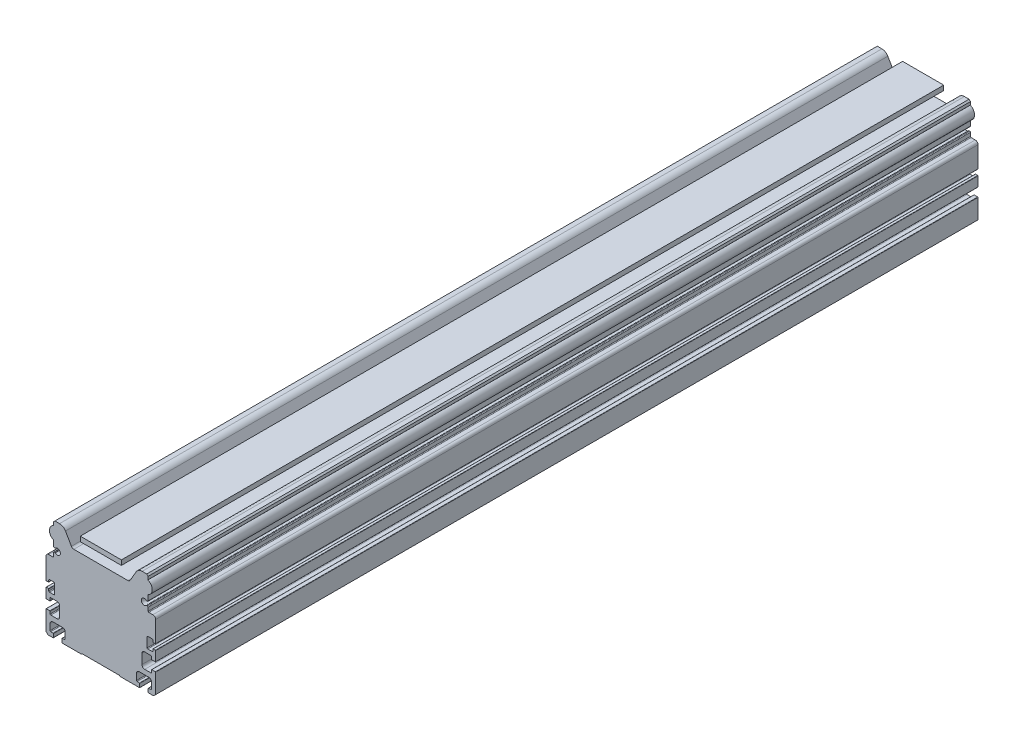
SolidWorks part; units mm, degrees
ref_plane "前视基准面" through (0, 0, 0) normal (0, 0, 1) x (1, 0, 0)
ref_plane "上视基准面" through (0, 0, 0) normal (0, 1, 0) x (1, 0, 0)
ref_plane "右视基准面" through (0, 0, 0) normal (1, 0, 0) x (0, 0, -1)
sketch "草图1" plane through (0, 0, 0) normal (0, 0, 1) x (1, 0, 0)
  line L0 (198.8889, 143.3954) -> (159.4513, 143.3954)
  line L1 (213.6701, 137.8954) -> (213.6701, 141.5168)
  line L2 (213.6701, 131.3954) -> (213.6701, 133.8954)
  line L3 (217.1701, 130.8954) -> (214.1701, 130.8954)
  line L4 (219.1701, 113.5954) -> (219.1701, 128.8954)
  line L5 (213.4701, 115.3954) -> (216.6701, 115.3954)
  line L6 (212.9701, 107.8954) -> (212.9701, 114.8954)
  line L7 (216.6701, 107.3954) -> (213.4701, 107.3954)
  line L8 (219.1701, 102.1954) -> (219.1701, 109.1954)
  line L9 (216.3701, 101.9954) -> (218.9701, 101.9954)
  line L10 (211.1701, 104.3954) -> (215.6701, 104.3954)
  line L11 (209.1701, 95.3954) -> (209.1701, 102.3954)
  line L12 (215.6701, 93.3954) -> (211.1701, 93.3954)
  line L13 (218.9701, 95.7954) -> (216.3701, 95.7954)
  line L14 (219.1701, 81.3954) -> (219.1701, 95.5954)
  line L15 (217.6701, 79.8954) -> (219.1701, 81.3954)
  line L16 (213.9701, 79.8954) -> (217.6701, 79.8954)
  line L17 (213.7701, 82.6954) -> (213.7701, 80.0954)
  line L18 (216.1701, 87.8954) -> (216.1701, 83.3954)
  line L19 (207.1701, 89.8954) -> (214.1701, 89.8954)
  line L20 (205.1701, 83.3954) -> (205.1701, 87.8954)
  line L21 (207.5701, 80.0954) -> (207.5701, 82.6954)
  line L22 (193.1701, 79.8954) -> (207.3701, 79.8954)
  line L23 (165.6701, 80.3954) -> (192.6701, 80.3954)
  line L24 (150.9701, 79.8954) -> (165.1701, 79.8954)
  line L25 (150.7701, 82.6954) -> (150.7701, 80.0954)
  line L26 (153.1701, 87.8954) -> (153.1701, 83.3954)
  line L27 (144.1701, 89.8954) -> (151.1701, 89.8954)
  line L28 (142.1701, 83.3954) -> (142.1701, 87.8954)
  line L29 (144.5701, 80.0954) -> (144.5701, 82.6954)
  line L30 (140.6701, 79.8954) -> (144.3701, 79.8954)
  line L31 (139.1701, 81.3954) -> (140.6701, 79.8954)
  line L32 (139.1701, 95.5954) -> (139.1701, 81.3954)
  line L33 (141.9701, 95.7954) -> (139.3701, 95.7954)
  line L34 (147.1701, 93.3954) -> (142.6701, 93.3954)
  line L35 (149.1701, 102.3954) -> (149.1701, 95.3954)
  line L36 (142.6701, 104.3954) -> (147.1701, 104.3954)
  line L37 (139.3701, 101.9954) -> (141.9701, 101.9954)
  line L38 (139.1701, 109.1954) -> (139.1701, 102.1954)
  line L39 (144.8701, 107.3954) -> (141.6701, 107.3954)
  line L40 (145.3701, 114.8954) -> (145.3701, 107.8954)
  line L41 (141.6701, 115.3954) -> (144.8701, 115.3954)
  line L42 (139.1701, 128.8954) -> (139.1701, 113.5954)
  line L43 (144.1701, 130.8954) -> (141.1701, 130.8954)
  line L44 (144.6701, 133.8954) -> (144.6701, 131.3954)
  line L45 (144.6701, 141.5168) -> (144.6701, 137.8954)
  line L46 (144.6701, 153.3954) -> (144.6701, 151.2739)
  line L47 (149.059, 154.3954) -> (145.6701, 154.3954)
  line L48 (157.7193, 144.3954) -> (153.3892, 151.8954)
  line L49 (204.951, 151.8954) -> (200.6209, 144.3954)
  line L50 (212.6701, 154.3954) -> (209.2812, 154.3954)
  line L51 (213.6701, 151.2739) -> (213.6701, 153.3954)
  line L52 (192.6701, 80.3954) -> (193.1701, 79.8954)
  line L53 (165.1701, 79.8954) -> (165.6701, 80.3954)
  line L54 (145.6701, 154.3954) -> (144.6701, 153.3954)
  line L55 (213.6701, 153.3954) -> (212.6701, 154.3954)
  line L56 (212.5642, 137.3954) -> (213.1701, 137.3954)
  line L57 (213.1701, 134.3954) -> (212.5642, 134.3954)
  line L58 (217.3701, 113.3954) -> (218.9701, 113.3954)
  line L59 (217.1701, 114.8954) -> (217.1701, 113.5954)
  line L60 (217.1701, 109.1954) -> (217.1701, 107.8954)
  line L61 (218.9701, 109.3954) -> (217.3701, 109.3954)
  line L62 (216.1701, 103.8954) -> (216.1701, 102.1954)
  line L63 (216.1701, 95.5954) -> (216.1701, 93.8954)
  line L64 (215.6701, 82.8954) -> (213.9701, 82.8954)
  line L65 (207.3701, 82.8954) -> (205.6701, 82.8954)
  line L66 (152.6701, 82.8954) -> (150.9701, 82.8954)
  line L67 (144.3701, 82.8954) -> (142.6701, 82.8954)
  line L68 (142.1701, 93.8954) -> (142.1701, 95.5954)
  line L69 (142.1701, 102.1954) -> (142.1701, 103.8954)
  line L70 (140.9701, 109.3954) -> (139.3701, 109.3954)
  line L71 (141.1701, 107.8954) -> (141.1701, 109.1954)
  line L72 (141.1701, 113.5954) -> (141.1701, 114.8954)
  line L73 (139.3701, 113.3954) -> (140.9701, 113.3954)
  line L74 (145.776, 134.3954) -> (145.1701, 134.3954)
  line L75 (145.1701, 137.3954) -> (145.776, 137.3954)
  line L76 (164.1701, 150.5454) -> (194.1701, 150.5454)
  line L77 (164.1701, 154.0454) -> (164.1701, 150.5454)
  line L78 (164.1701, 154.0454) -> (194.1701, 154.0454)
  line L79 (194.1701, 154.0454) -> (194.1701, 150.5454)
  arc A0 (157.7193, 144.3954) -> (159.4513, 143.3954) centre (159.4513, 145.3954) ccw
  arc A1 (198.8889, 143.3954) -> (200.6209, 144.3954) centre (198.8889, 145.3954) ccw
  arc A2 (149.2956, 142.1401) -> (150.9253, 143.7699) centre (146.6701, 146.3954) ccw
  arc A3 (149.5348, 142.1183) -> (150.9472, 143.5307) centre (150.2056, 142.8598) ccw
  arc A4 (207.4149, 143.7699) -> (209.0446, 142.1401) centre (211.6701, 146.3954) ccw
  arc A5 (207.393, 143.5307) -> (208.8054, 142.1183) centre (208.0992, 142.8245) ccw
  arc A6 (213.4009, 141.7045) -> (213.4009, 151.0862) centre (211.6701, 146.3954) ccw
  arc A7 (212.423, 137.4537) -> (212.423, 134.337) centre (210.8701, 135.8954) ccw
  arc A8 (219.1701, 128.8954) -> (217.1701, 130.8954) centre (217.1701, 128.8954) ccw
  arc A9 (211.1701, 104.3954) -> (209.1701, 102.3954) centre (211.1701, 102.3954) ccw
  arc A10 (209.1701, 95.3954) -> (211.1701, 93.3954) centre (211.1701, 95.3954) ccw
  arc A11 (216.1701, 87.8954) -> (214.1701, 89.8954) centre (214.1701, 87.8954) ccw
  arc A12 (207.1701, 89.8954) -> (205.1701, 87.8954) centre (207.1701, 87.8954) ccw
  arc A13 (153.1701, 87.8954) -> (151.1701, 89.8954) centre (151.1701, 87.8954) ccw
  arc A14 (144.1701, 89.8954) -> (142.1701, 87.8954) centre (144.1701, 87.8954) ccw
  arc A15 (147.1701, 93.3954) -> (149.1701, 95.3954) centre (147.1701, 95.3954) ccw
  arc A16 (149.1701, 102.3954) -> (147.1701, 104.3954) centre (147.1701, 102.3954) ccw
  arc A17 (141.1701, 130.8954) -> (139.1701, 128.8954) centre (141.1701, 128.8954) ccw
  arc A18 (145.9172, 134.337) -> (145.9172, 137.4537) centre (147.4701, 135.8954) ccw
  arc A19 (144.9393, 151.0862) -> (144.9393, 141.7045) centre (146.6701, 146.3954) ccw
  arc A20 (153.3892, 151.8954) -> (149.059, 154.3954) centre (149.059, 149.3954) ccw
  arc A21 (209.2812, 154.3954) -> (204.951, 151.8954) centre (209.2812, 149.3954) ccw
  arc A22 (149.5348, 142.1183) -> (149.2956, 142.1401) centre (149.4006, 141.9699) ccw
  arc A23 (150.9253, 143.7699) -> (150.9472, 143.5307) centre (151.0955, 143.6649) ccw
  arc A24 (207.393, 143.5307) -> (207.4149, 143.7699) centre (207.2447, 143.6649) ccw
  arc A25 (209.0446, 142.1401) -> (208.8054, 142.1183) centre (208.9396, 141.9699) ccw
  arc A26 (213.4009, 151.0862) -> (213.6701, 151.2739) centre (213.4701, 151.2739) ccw
  arc A27 (213.6701, 141.5168) -> (213.4009, 141.7045) centre (213.4701, 141.5168) ccw
  arc A28 (213.1701, 137.3954) -> (213.6701, 137.8954) centre (213.1701, 137.8954) ccw
  arc A29 (212.423, 137.4537) -> (212.5642, 137.3954) centre (212.5642, 137.5954) ccw
  arc A30 (212.5642, 134.3954) -> (212.423, 134.337) centre (212.5642, 134.1954) ccw
  arc A31 (213.6701, 133.8954) -> (213.1701, 134.3954) centre (213.1701, 133.8954) ccw
  arc A32 (213.6701, 131.3954) -> (214.1701, 130.8954) centre (214.1701, 131.3954) ccw
  arc A33 (218.9701, 113.3954) -> (219.1701, 113.5954) centre (218.9701, 113.5954) ccw
  arc A34 (217.1701, 114.8954) -> (216.6701, 115.3954) centre (216.6701, 114.8954) ccw
  arc A35 (213.4701, 115.3954) -> (212.9701, 114.8954) centre (213.4701, 114.8954) ccw
  arc A36 (212.9701, 107.8954) -> (213.4701, 107.3954) centre (213.4701, 107.8954) ccw
  arc A37 (216.6701, 107.3954) -> (217.1701, 107.8954) centre (216.6701, 107.8954) ccw
  arc A38 (219.1701, 109.1954) -> (218.9701, 109.3954) centre (218.9701, 109.1954) ccw
  arc A39 (218.9701, 101.9954) -> (219.1701, 102.1954) centre (218.9701, 102.1954) ccw
  arc A40 (216.1701, 102.1954) -> (216.3701, 101.9954) centre (216.3701, 102.1954) ccw
  arc A41 (216.1701, 103.8954) -> (215.6701, 104.3954) centre (215.6701, 103.8954) ccw
  arc A42 (215.6701, 93.3954) -> (216.1701, 93.8954) centre (215.6701, 93.8954) ccw
  arc A43 (216.3701, 95.7954) -> (216.1701, 95.5954) centre (216.3701, 95.5954) ccw
  arc A44 (219.1701, 95.5954) -> (218.9701, 95.7954) centre (218.9701, 95.5954) ccw
  arc A45 (213.7701, 80.0954) -> (213.9701, 79.8954) centre (213.9701, 80.0954) ccw
  arc A46 (213.9701, 82.8954) -> (213.7701, 82.6954) centre (213.9701, 82.6954) ccw
  arc A47 (215.6701, 82.8954) -> (216.1701, 83.3954) centre (215.6701, 83.3954) ccw
  arc A48 (205.1701, 83.3954) -> (205.6701, 82.8954) centre (205.6701, 83.3954) ccw
  arc A49 (207.5701, 82.6954) -> (207.3701, 82.8954) centre (207.3701, 82.6954) ccw
  arc A50 (207.3701, 79.8954) -> (207.5701, 80.0954) centre (207.3701, 80.0954) ccw
  arc A51 (150.7701, 80.0954) -> (150.9701, 79.8954) centre (150.9701, 80.0954) ccw
  arc A52 (150.9701, 82.8954) -> (150.7701, 82.6954) centre (150.9701, 82.6954) ccw
  arc A53 (152.6701, 82.8954) -> (153.1701, 83.3954) centre (152.6701, 83.3954) ccw
  arc A54 (142.1701, 83.3954) -> (142.6701, 82.8954) centre (142.6701, 83.3954) ccw
  arc A55 (144.5701, 82.6954) -> (144.3701, 82.8954) centre (144.3701, 82.6954) ccw
  arc A56 (144.3701, 79.8954) -> (144.5701, 80.0954) centre (144.3701, 80.0954) ccw
  arc A57 (139.3701, 95.7954) -> (139.1701, 95.5954) centre (139.3701, 95.5954) ccw
  arc A58 (142.1701, 95.5954) -> (141.9701, 95.7954) centre (141.9701, 95.5954) ccw
  arc A59 (142.1701, 93.8954) -> (142.6701, 93.3954) centre (142.6701, 93.8954) ccw
  arc A60 (142.6701, 104.3954) -> (142.1701, 103.8954) centre (142.6701, 103.8954) ccw
  arc A61 (141.9701, 101.9954) -> (142.1701, 102.1954) centre (141.9701, 102.1954) ccw
  arc A62 (139.1701, 102.1954) -> (139.3701, 101.9954) centre (139.3701, 102.1954) ccw
  arc A63 (139.3701, 109.3954) -> (139.1701, 109.1954) centre (139.3701, 109.1954) ccw
  arc A64 (141.1701, 107.8954) -> (141.6701, 107.3954) centre (141.6701, 107.8954) ccw
  arc A65 (144.8701, 107.3954) -> (145.3701, 107.8954) centre (144.8701, 107.8954) ccw
  arc A66 (145.3701, 114.8954) -> (144.8701, 115.3954) centre (144.8701, 114.8954) ccw
  arc A67 (141.6701, 115.3954) -> (141.1701, 114.8954) centre (141.6701, 114.8954) ccw
  arc A68 (139.1701, 113.5954) -> (139.3701, 113.3954) centre (139.3701, 113.5954) ccw
  arc A69 (144.1701, 130.8954) -> (144.6701, 131.3954) centre (144.1701, 131.3954) ccw
  arc A70 (145.1701, 134.3954) -> (144.6701, 133.8954) centre (145.1701, 133.8954) ccw
  arc A71 (145.9172, 134.337) -> (145.776, 134.3954) centre (145.776, 134.1954) ccw
  arc A72 (145.776, 137.3954) -> (145.9172, 137.4537) centre (145.776, 137.5954) ccw
  arc A73 (144.6701, 137.8954) -> (145.1701, 137.3954) centre (145.1701, 137.8954) ccw
  arc A74 (144.9393, 141.7045) -> (144.6701, 141.5168) centre (144.8701, 141.5168) ccw
  arc A75 (144.6701, 151.2739) -> (144.9393, 151.0862) centre (144.8701, 151.2739) ccw
  arc A76 (217.1701, 113.5954) -> (217.3701, 113.3954) centre (217.3701, 113.5954) ccw
  arc A77 (217.3701, 109.3954) -> (217.1701, 109.1954) centre (217.3701, 109.1954) ccw
  arc A78 (141.1701, 109.1954) -> (140.9701, 109.3954) centre (140.9701, 109.1954) ccw
  arc A79 (140.9701, 113.3954) -> (141.1701, 113.5954) centre (140.9701, 113.5954) ccw
extrude "凸台-拉伸1" add sketch "草图1" along normal blind 600
sketch "草图2" plane through (0, 0, 600) normal (0, 0, 1) x (1, 0, 0)
  line L76 (157.7193, 144.3954) -> (153.3892, 151.8954)
  line L77 (149.059, 154.3954) -> (145.6701, 154.3954)
  line L78 (145.6701, 154.3954) -> (144.6701, 153.3954)
  line L79 (144.6701, 153.3954) -> (144.6701, 151.2739)
  line L80 (144.6701, 141.5168) -> (144.6701, 137.8954)
  line L81 (145.1701, 137.3954) -> (145.776, 137.3954)
  line L82 (145.776, 134.3954) -> (145.1701, 134.3954)
  line L83 (144.6701, 133.8954) -> (144.6701, 131.3954)
  line L84 (144.1701, 130.8954) -> (141.1701, 130.8954)
  line L85 (139.1701, 128.8954) -> (139.1701, 113.5954)
  line L86 (139.3701, 113.3954) -> (140.9701, 113.3954)
  line L87 (141.1701, 113.5954) -> (141.1701, 114.8954)
  line L88 (141.6701, 115.3954) -> (144.8701, 115.3954)
  line L89 (145.3701, 114.8954) -> (145.3701, 107.8954)
  line L90 (144.8701, 107.3954) -> (141.6701, 107.3954)
  line L91 (141.1701, 107.8954) -> (141.1701, 109.1954)
  line L92 (140.9701, 109.3954) -> (139.3701, 109.3954)
  line L93 (139.1701, 109.1954) -> (139.1701, 102.1954)
  line L94 (139.3701, 101.9954) -> (141.9701, 101.9954)
  line L95 (142.1701, 102.1954) -> (142.1701, 103.8954)
  line L96 (142.6701, 104.3954) -> (147.1701, 104.3954)
  line L97 (149.1701, 102.3954) -> (149.1701, 95.3954)
  line L98 (147.1701, 93.3954) -> (142.6701, 93.3954)
  line L99 (142.1701, 93.8954) -> (142.1701, 95.5954)
  line L100 (141.9701, 95.7954) -> (139.3701, 95.7954)
  line L101 (139.1701, 95.5954) -> (139.1701, 81.3954)
  line L102 (139.1701, 81.3954) -> (140.6701, 79.8954)
  line L103 (140.6701, 79.8954) -> (144.3701, 79.8954)
  line L104 (144.5701, 80.0954) -> (144.5701, 82.6954)
  line L105 (144.3701, 82.8954) -> (142.6701, 82.8954)
  line L106 (142.1701, 83.3954) -> (142.1701, 87.8954)
  line L107 (144.1701, 89.8954) -> (151.1701, 89.8954)
  line L108 (153.1701, 87.8954) -> (153.1701, 83.3954)
  line L109 (152.6701, 82.8954) -> (150.9701, 82.8954)
  line L110 (150.7701, 82.6954) -> (150.7701, 80.0954)
  line L111 (150.9701, 79.8954) -> (165.1701, 79.8954)
  line L112 (165.1701, 79.8954) -> (165.6701, 80.3954)
  line L113 (165.6701, 80.3954) -> (192.6701, 80.3954)
  line L114 (192.6701, 80.3954) -> (193.1701, 79.8954)
  line L115 (193.1701, 79.8954) -> (207.3701, 79.8954)
  line L116 (207.5701, 80.0954) -> (207.5701, 82.6954)
  line L117 (207.3701, 82.8954) -> (205.6701, 82.8954)
  line L118 (205.1701, 83.3954) -> (205.1701, 87.8954)
  line L119 (207.1701, 89.8954) -> (214.1701, 89.8954)
  line L120 (216.1701, 87.8954) -> (216.1701, 83.3954)
  line L121 (215.6701, 82.8954) -> (213.9701, 82.8954)
  line L122 (213.7701, 82.6954) -> (213.7701, 80.0954)
  line L123 (213.9701, 79.8954) -> (217.6701, 79.8954)
  line L124 (217.6701, 79.8954) -> (219.1701, 81.3954)
  line L125 (219.1701, 81.3954) -> (219.1701, 95.5954)
  line L126 (218.9701, 95.7954) -> (216.3701, 95.7954)
  line L127 (216.1701, 95.5954) -> (216.1701, 93.8954)
  line L128 (215.6701, 93.3954) -> (211.1701, 93.3954)
  line L129 (209.1701, 95.3954) -> (209.1701, 102.3954)
  line L130 (211.1701, 104.3954) -> (215.6701, 104.3954)
  line L131 (216.1701, 103.8954) -> (216.1701, 102.1954)
  line L132 (216.3701, 101.9954) -> (218.9701, 101.9954)
  line L133 (219.1701, 102.1954) -> (219.1701, 109.1954)
  line L134 (218.9701, 109.3954) -> (217.3701, 109.3954)
  line L135 (217.1701, 109.1954) -> (217.1701, 107.8954)
  line L136 (216.6701, 107.3954) -> (213.4701, 107.3954)
  line L137 (212.9701, 107.8954) -> (212.9701, 114.8954)
  line L138 (213.4701, 115.3954) -> (216.6701, 115.3954)
  line L139 (217.1701, 114.8954) -> (217.1701, 113.5954)
  line L140 (217.3701, 113.3954) -> (218.9701, 113.3954)
  line L141 (219.1701, 113.5954) -> (219.1701, 128.8954)
  line L142 (217.1701, 130.8954) -> (214.1701, 130.8954)
  line L143 (213.6701, 131.3954) -> (213.6701, 133.8954)
  line L144 (213.1701, 134.3954) -> (212.5642, 134.3954)
  line L145 (212.5642, 137.3954) -> (213.1701, 137.3954)
  line L146 (213.6701, 137.8954) -> (213.6701, 141.5168)
  line L147 (213.6701, 151.2739) -> (213.6701, 153.3954)
  line L148 (213.6701, 153.3954) -> (212.6701, 154.3954)
  line L149 (212.6701, 154.3954) -> (209.2812, 154.3954)
  line L150 (204.951, 151.8954) -> (200.6209, 144.3954)
  line L151 (198.8889, 143.3954) -> (159.4513, 143.3954)
  line L152 (157.7193, 144.3954) -> (153.3892, 151.8954)
  line L153 (149.059, 154.3954) -> (145.6701, 154.3954)
  line L154 (145.6701, 154.3954) -> (144.6701, 153.3954)
  line L155 (144.6701, 153.3954) -> (144.6701, 151.2739)
  line L156 (144.6701, 141.5168) -> (144.6701, 137.8954)
  line L157 (145.1701, 137.3954) -> (145.776, 137.3954)
  line L158 (145.776, 134.3954) -> (145.1701, 134.3954)
  line L159 (144.6701, 133.8954) -> (144.6701, 131.3954)
  line L160 (144.1701, 130.8954) -> (141.1701, 130.8954)
  line L161 (139.1701, 128.8954) -> (139.1701, 113.5954)
  line L162 (139.3701, 113.3954) -> (140.9701, 113.3954)
  line L163 (141.1701, 113.5954) -> (141.1701, 114.8954)
  line L164 (141.6701, 115.3954) -> (144.8701, 115.3954)
  line L165 (145.3701, 114.8954) -> (145.3701, 107.8954)
  line L166 (144.8701, 107.3954) -> (141.6701, 107.3954)
  line L167 (141.1701, 107.8954) -> (141.1701, 109.1954)
  line L168 (140.9701, 109.3954) -> (139.3701, 109.3954)
  line L169 (139.1701, 109.1954) -> (139.1701, 102.1954)
  line L170 (139.3701, 101.9954) -> (141.9701, 101.9954)
  line L171 (142.1701, 102.1954) -> (142.1701, 103.8954)
  line L172 (142.6701, 104.3954) -> (147.1701, 104.3954)
  line L173 (149.1701, 102.3954) -> (149.1701, 95.3954)
  line L174 (147.1701, 93.3954) -> (142.6701, 93.3954)
  line L175 (142.1701, 93.8954) -> (142.1701, 95.5954)
  line L176 (141.9701, 95.7954) -> (139.3701, 95.7954)
  line L177 (139.1701, 95.5954) -> (139.1701, 81.3954)
  line L178 (139.1701, 81.3954) -> (140.6701, 79.8954)
  line L179 (140.6701, 79.8954) -> (144.3701, 79.8954)
  line L180 (144.5701, 80.0954) -> (144.5701, 82.6954)
  line L181 (144.3701, 82.8954) -> (142.6701, 82.8954)
  line L182 (142.1701, 83.3954) -> (142.1701, 87.8954)
  line L183 (144.1701, 89.8954) -> (151.1701, 89.8954)
  line L184 (153.1701, 87.8954) -> (153.1701, 83.3954)
  line L185 (152.6701, 82.8954) -> (150.9701, 82.8954)
  line L186 (150.7701, 82.6954) -> (150.7701, 80.0954)
  line L187 (150.9701, 79.8954) -> (165.1701, 79.8954)
  line L188 (165.1701, 79.8954) -> (165.6701, 80.3954)
  line L189 (165.6701, 80.3954) -> (192.6701, 80.3954)
  line L190 (192.6701, 80.3954) -> (193.1701, 79.8954)
  line L191 (193.1701, 79.8954) -> (207.3701, 79.8954)
  line L192 (207.5701, 80.0954) -> (207.5701, 82.6954)
  line L193 (207.3701, 82.8954) -> (205.6701, 82.8954)
  line L194 (205.1701, 83.3954) -> (205.1701, 87.8954)
  line L195 (207.1701, 89.8954) -> (214.1701, 89.8954)
  line L196 (216.1701, 87.8954) -> (216.1701, 83.3954)
  line L197 (215.6701, 82.8954) -> (213.9701, 82.8954)
  line L198 (213.7701, 82.6954) -> (213.7701, 80.0954)
  line L199 (213.9701, 79.8954) -> (217.6701, 79.8954)
  line L200 (217.6701, 79.8954) -> (219.1701, 81.3954)
  line L201 (219.1701, 81.3954) -> (219.1701, 95.5954)
  line L202 (218.9701, 95.7954) -> (216.3701, 95.7954)
  line L203 (216.1701, 95.5954) -> (216.1701, 93.8954)
  line L204 (215.6701, 93.3954) -> (211.1701, 93.3954)
  line L205 (209.1701, 95.3954) -> (209.1701, 102.3954)
  line L206 (211.1701, 104.3954) -> (215.6701, 104.3954)
  line L207 (216.1701, 103.8954) -> (216.1701, 102.1954)
  line L208 (216.3701, 101.9954) -> (218.9701, 101.9954)
  line L209 (219.1701, 102.1954) -> (219.1701, 109.1954)
  line L210 (218.9701, 109.3954) -> (217.3701, 109.3954)
  line L211 (217.1701, 109.1954) -> (217.1701, 107.8954)
  line L212 (216.6701, 107.3954) -> (213.4701, 107.3954)
  line L213 (212.9701, 107.8954) -> (212.9701, 114.8954)
  line L214 (213.4701, 115.3954) -> (216.6701, 115.3954)
  line L215 (217.1701, 114.8954) -> (217.1701, 113.5954)
  line L216 (217.3701, 113.3954) -> (218.9701, 113.3954)
  line L217 (219.1701, 113.5954) -> (219.1701, 128.8954)
  line L218 (217.1701, 130.8954) -> (214.1701, 130.8954)
  line L219 (213.6701, 131.3954) -> (213.6701, 133.8954)
  line L220 (213.1701, 134.3954) -> (212.5642, 134.3954)
  line L221 (212.5642, 137.3954) -> (213.1701, 137.3954)
  line L222 (213.6701, 137.8954) -> (213.6701, 141.5168)
  line L223 (213.6701, 151.2739) -> (213.6701, 153.3954)
  line L224 (213.6701, 153.3954) -> (212.6701, 154.3954)
  line L225 (212.6701, 154.3954) -> (209.2812, 154.3954)
  line L226 (204.951, 151.8954) -> (200.6209, 144.3954)
  line L227 (198.8889, 143.3954) -> (159.4513, 143.3954)
  arc A72 (157.7193, 144.3954) -> (159.4513, 143.3954) centre (159.4513, 145.3954) ccw
  arc A73 (153.3892, 151.8954) -> (149.059, 154.3954) centre (149.059, 149.3954) ccw
  arc A74 (144.6701, 151.2739) -> (144.9393, 151.0862) centre (144.8701, 151.2739) ccw
  arc A75 (144.9393, 151.0862) -> (144.9393, 141.7045) centre (146.6701, 146.3954) ccw
  arc A76 (144.9393, 141.7045) -> (144.6701, 141.5168) centre (144.8701, 141.5168) ccw
  arc A77 (144.6701, 137.8954) -> (145.1701, 137.3954) centre (145.1701, 137.8954) ccw
  arc A78 (145.776, 137.3954) -> (145.9172, 137.4537) centre (145.776, 137.5954) ccw
  arc A79 (145.9172, 134.337) -> (145.9172, 137.4537) centre (147.4701, 135.8954) ccw
  arc A80 (145.9172, 134.337) -> (145.776, 134.3954) centre (145.776, 134.1954) ccw
  arc A81 (145.1701, 134.3954) -> (144.6701, 133.8954) centre (145.1701, 133.8954) ccw
  arc A82 (144.1701, 130.8954) -> (144.6701, 131.3954) centre (144.1701, 131.3954) ccw
  arc A83 (141.1701, 130.8954) -> (139.1701, 128.8954) centre (141.1701, 128.8954) ccw
  arc A84 (139.1701, 113.5954) -> (139.3701, 113.3954) centre (139.3701, 113.5954) ccw
  arc A85 (140.9701, 113.3954) -> (141.1701, 113.5954) centre (140.9701, 113.5954) ccw
  arc A86 (141.6701, 115.3954) -> (141.1701, 114.8954) centre (141.6701, 114.8954) ccw
  arc A87 (145.3701, 114.8954) -> (144.8701, 115.3954) centre (144.8701, 114.8954) ccw
  arc A88 (144.8701, 107.3954) -> (145.3701, 107.8954) centre (144.8701, 107.8954) ccw
  arc A89 (141.1701, 107.8954) -> (141.6701, 107.3954) centre (141.6701, 107.8954) ccw
  arc A90 (141.1701, 109.1954) -> (140.9701, 109.3954) centre (140.9701, 109.1954) ccw
  arc A91 (139.3701, 109.3954) -> (139.1701, 109.1954) centre (139.3701, 109.1954) ccw
  arc A92 (139.1701, 102.1954) -> (139.3701, 101.9954) centre (139.3701, 102.1954) ccw
  arc A93 (141.9701, 101.9954) -> (142.1701, 102.1954) centre (141.9701, 102.1954) ccw
  arc A94 (142.6701, 104.3954) -> (142.1701, 103.8954) centre (142.6701, 103.8954) ccw
  arc A95 (149.1701, 102.3954) -> (147.1701, 104.3954) centre (147.1701, 102.3954) ccw
  arc A96 (147.1701, 93.3954) -> (149.1701, 95.3954) centre (147.1701, 95.3954) ccw
  arc A97 (142.1701, 93.8954) -> (142.6701, 93.3954) centre (142.6701, 93.8954) ccw
  arc A98 (142.1701, 95.5954) -> (141.9701, 95.7954) centre (141.9701, 95.5954) ccw
  arc A99 (139.3701, 95.7954) -> (139.1701, 95.5954) centre (139.3701, 95.5954) ccw
  arc A100 (144.3701, 79.8954) -> (144.5701, 80.0954) centre (144.3701, 80.0954) ccw
  arc A101 (144.5701, 82.6954) -> (144.3701, 82.8954) centre (144.3701, 82.6954) ccw
  arc A102 (142.1701, 83.3954) -> (142.6701, 82.8954) centre (142.6701, 83.3954) ccw
  arc A103 (144.1701, 89.8954) -> (142.1701, 87.8954) centre (144.1701, 87.8954) ccw
  arc A104 (153.1701, 87.8954) -> (151.1701, 89.8954) centre (151.1701, 87.8954) ccw
  arc A105 (152.6701, 82.8954) -> (153.1701, 83.3954) centre (152.6701, 83.3954) ccw
  arc A106 (150.9701, 82.8954) -> (150.7701, 82.6954) centre (150.9701, 82.6954) ccw
  arc A107 (150.7701, 80.0954) -> (150.9701, 79.8954) centre (150.9701, 80.0954) ccw
  arc A108 (207.3701, 79.8954) -> (207.5701, 80.0954) centre (207.3701, 80.0954) ccw
  arc A109 (207.5701, 82.6954) -> (207.3701, 82.8954) centre (207.3701, 82.6954) ccw
  arc A110 (205.1701, 83.3954) -> (205.6701, 82.8954) centre (205.6701, 83.3954) ccw
  arc A111 (207.1701, 89.8954) -> (205.1701, 87.8954) centre (207.1701, 87.8954) ccw
  arc A112 (216.1701, 87.8954) -> (214.1701, 89.8954) centre (214.1701, 87.8954) ccw
  arc A113 (215.6701, 82.8954) -> (216.1701, 83.3954) centre (215.6701, 83.3954) ccw
  arc A114 (213.9701, 82.8954) -> (213.7701, 82.6954) centre (213.9701, 82.6954) ccw
  arc A115 (213.7701, 80.0954) -> (213.9701, 79.8954) centre (213.9701, 80.0954) ccw
  arc A116 (219.1701, 95.5954) -> (218.9701, 95.7954) centre (218.9701, 95.5954) ccw
  arc A117 (216.3701, 95.7954) -> (216.1701, 95.5954) centre (216.3701, 95.5954) ccw
  arc A118 (215.6701, 93.3954) -> (216.1701, 93.8954) centre (215.6701, 93.8954) ccw
  arc A119 (209.1701, 95.3954) -> (211.1701, 93.3954) centre (211.1701, 95.3954) ccw
  arc A120 (211.1701, 104.3954) -> (209.1701, 102.3954) centre (211.1701, 102.3954) ccw
  arc A121 (216.1701, 103.8954) -> (215.6701, 104.3954) centre (215.6701, 103.8954) ccw
  arc A122 (216.1701, 102.1954) -> (216.3701, 101.9954) centre (216.3701, 102.1954) ccw
  arc A123 (218.9701, 101.9954) -> (219.1701, 102.1954) centre (218.9701, 102.1954) ccw
  arc A124 (219.1701, 109.1954) -> (218.9701, 109.3954) centre (218.9701, 109.1954) ccw
  arc A125 (217.3701, 109.3954) -> (217.1701, 109.1954) centre (217.3701, 109.1954) ccw
  arc A126 (216.6701, 107.3954) -> (217.1701, 107.8954) centre (216.6701, 107.8954) ccw
  arc A127 (212.9701, 107.8954) -> (213.4701, 107.3954) centre (213.4701, 107.8954) ccw
  arc A128 (213.4701, 115.3954) -> (212.9701, 114.8954) centre (213.4701, 114.8954) ccw
  arc A129 (217.1701, 114.8954) -> (216.6701, 115.3954) centre (216.6701, 114.8954) ccw
  arc A130 (217.1701, 113.5954) -> (217.3701, 113.3954) centre (217.3701, 113.5954) ccw
  arc A131 (218.9701, 113.3954) -> (219.1701, 113.5954) centre (218.9701, 113.5954) ccw
  arc A132 (219.1701, 128.8954) -> (217.1701, 130.8954) centre (217.1701, 128.8954) ccw
  arc A133 (213.6701, 131.3954) -> (214.1701, 130.8954) centre (214.1701, 131.3954) ccw
  arc A134 (213.6701, 133.8954) -> (213.1701, 134.3954) centre (213.1701, 133.8954) ccw
  arc A135 (212.5642, 134.3954) -> (212.423, 134.337) centre (212.5642, 134.1954) ccw
  arc A136 (212.423, 137.4537) -> (212.423, 134.337) centre (210.8701, 135.8954) ccw
  arc A137 (212.423, 137.4537) -> (212.5642, 137.3954) centre (212.5642, 137.5954) ccw
  arc A138 (213.1701, 137.3954) -> (213.6701, 137.8954) centre (213.1701, 137.8954) ccw
  arc A139 (213.6701, 141.5168) -> (213.4009, 141.7045) centre (213.4701, 141.5168) ccw
  arc A140 (213.4009, 141.7045) -> (213.4009, 151.0862) centre (211.6701, 146.3954) ccw
  arc A141 (213.4009, 151.0862) -> (213.6701, 151.2739) centre (213.4701, 151.2739) ccw
  arc A142 (209.2812, 154.3954) -> (204.951, 151.8954) centre (209.2812, 149.3954) ccw
  arc A143 (198.8889, 143.3954) -> (200.6209, 144.3954) centre (198.8889, 145.3954) ccw
  arc A144 (157.7193, 144.3954) -> (159.4513, 143.3954) centre (159.4513, 145.3954) ccw
  arc A145 (153.3892, 151.8954) -> (149.059, 154.3954) centre (149.059, 149.3954) ccw
  arc A146 (144.6701, 151.2739) -> (144.9393, 151.0862) centre (144.8701, 151.2739) ccw
  arc A147 (144.9393, 151.0862) -> (144.9393, 141.7045) centre (146.6701, 146.3954) ccw
  arc A148 (144.9393, 141.7045) -> (144.6701, 141.5168) centre (144.8701, 141.5168) ccw
  arc A149 (144.6701, 137.8954) -> (145.1701, 137.3954) centre (145.1701, 137.8954) ccw
  arc A150 (145.776, 137.3954) -> (145.9172, 137.4537) centre (145.776, 137.5954) ccw
  arc A151 (145.9172, 134.337) -> (145.9172, 137.4537) centre (147.4701, 135.8954) ccw
  arc A152 (145.9172, 134.337) -> (145.776, 134.3954) centre (145.776, 134.1954) ccw
  arc A153 (145.1701, 134.3954) -> (144.6701, 133.8954) centre (145.1701, 133.8954) ccw
  arc A154 (144.1701, 130.8954) -> (144.6701, 131.3954) centre (144.1701, 131.3954) ccw
  arc A155 (141.1701, 130.8954) -> (139.1701, 128.8954) centre (141.1701, 128.8954) ccw
  arc A156 (139.1701, 113.5954) -> (139.3701, 113.3954) centre (139.3701, 113.5954) ccw
  arc A157 (140.9701, 113.3954) -> (141.1701, 113.5954) centre (140.9701, 113.5954) ccw
  arc A158 (141.6701, 115.3954) -> (141.1701, 114.8954) centre (141.6701, 114.8954) ccw
  arc A159 (145.3701, 114.8954) -> (144.8701, 115.3954) centre (144.8701, 114.8954) ccw
  arc A160 (144.8701, 107.3954) -> (145.3701, 107.8954) centre (144.8701, 107.8954) ccw
  arc A161 (141.1701, 107.8954) -> (141.6701, 107.3954) centre (141.6701, 107.8954) ccw
  arc A162 (141.1701, 109.1954) -> (140.9701, 109.3954) centre (140.9701, 109.1954) ccw
  arc A163 (139.3701, 109.3954) -> (139.1701, 109.1954) centre (139.3701, 109.1954) ccw
  arc A164 (139.1701, 102.1954) -> (139.3701, 101.9954) centre (139.3701, 102.1954) ccw
  arc A165 (141.9701, 101.9954) -> (142.1701, 102.1954) centre (141.9701, 102.1954) ccw
  arc A166 (142.6701, 104.3954) -> (142.1701, 103.8954) centre (142.6701, 103.8954) ccw
  arc A167 (149.1701, 102.3954) -> (147.1701, 104.3954) centre (147.1701, 102.3954) ccw
  arc A168 (147.1701, 93.3954) -> (149.1701, 95.3954) centre (147.1701, 95.3954) ccw
  arc A169 (142.1701, 93.8954) -> (142.6701, 93.3954) centre (142.6701, 93.8954) ccw
  arc A170 (142.1701, 95.5954) -> (141.9701, 95.7954) centre (141.9701, 95.5954) ccw
  arc A171 (139.3701, 95.7954) -> (139.1701, 95.5954) centre (139.3701, 95.5954) ccw
  arc A172 (144.3701, 79.8954) -> (144.5701, 80.0954) centre (144.3701, 80.0954) ccw
  arc A173 (144.5701, 82.6954) -> (144.3701, 82.8954) centre (144.3701, 82.6954) ccw
  arc A174 (142.1701, 83.3954) -> (142.6701, 82.8954) centre (142.6701, 83.3954) ccw
  arc A175 (144.1701, 89.8954) -> (142.1701, 87.8954) centre (144.1701, 87.8954) ccw
  arc A176 (153.1701, 87.8954) -> (151.1701, 89.8954) centre (151.1701, 87.8954) ccw
  arc A177 (152.6701, 82.8954) -> (153.1701, 83.3954) centre (152.6701, 83.3954) ccw
  arc A178 (150.9701, 82.8954) -> (150.7701, 82.6954) centre (150.9701, 82.6954) ccw
  arc A179 (150.7701, 80.0954) -> (150.9701, 79.8954) centre (150.9701, 80.0954) ccw
  arc A180 (207.3701, 79.8954) -> (207.5701, 80.0954) centre (207.3701, 80.0954) ccw
  arc A181 (207.5701, 82.6954) -> (207.3701, 82.8954) centre (207.3701, 82.6954) ccw
  arc A182 (205.1701, 83.3954) -> (205.6701, 82.8954) centre (205.6701, 83.3954) ccw
  arc A183 (207.1701, 89.8954) -> (205.1701, 87.8954) centre (207.1701, 87.8954) ccw
  arc A184 (216.1701, 87.8954) -> (214.1701, 89.8954) centre (214.1701, 87.8954) ccw
  arc A185 (215.6701, 82.8954) -> (216.1701, 83.3954) centre (215.6701, 83.3954) ccw
  arc A186 (213.9701, 82.8954) -> (213.7701, 82.6954) centre (213.9701, 82.6954) ccw
  arc A187 (213.7701, 80.0954) -> (213.9701, 79.8954) centre (213.9701, 80.0954) ccw
  arc A188 (219.1701, 95.5954) -> (218.9701, 95.7954) centre (218.9701, 95.5954) ccw
  arc A189 (216.3701, 95.7954) -> (216.1701, 95.5954) centre (216.3701, 95.5954) ccw
  arc A190 (215.6701, 93.3954) -> (216.1701, 93.8954) centre (215.6701, 93.8954) ccw
  arc A191 (209.1701, 95.3954) -> (211.1701, 93.3954) centre (211.1701, 95.3954) ccw
  arc A192 (211.1701, 104.3954) -> (209.1701, 102.3954) centre (211.1701, 102.3954) ccw
  arc A193 (216.1701, 103.8954) -> (215.6701, 104.3954) centre (215.6701, 103.8954) ccw
  arc A194 (216.1701, 102.1954) -> (216.3701, 101.9954) centre (216.3701, 102.1954) ccw
  arc A195 (218.9701, 101.9954) -> (219.1701, 102.1954) centre (218.9701, 102.1954) ccw
  arc A196 (219.1701, 109.1954) -> (218.9701, 109.3954) centre (218.9701, 109.1954) ccw
  arc A197 (217.3701, 109.3954) -> (217.1701, 109.1954) centre (217.3701, 109.1954) ccw
  arc A198 (216.6701, 107.3954) -> (217.1701, 107.8954) centre (216.6701, 107.8954) ccw
  arc A199 (212.9701, 107.8954) -> (213.4701, 107.3954) centre (213.4701, 107.8954) ccw
  arc A200 (213.4701, 115.3954) -> (212.9701, 114.8954) centre (213.4701, 114.8954) ccw
  arc A201 (217.1701, 114.8954) -> (216.6701, 115.3954) centre (216.6701, 114.8954) ccw
  arc A202 (217.1701, 113.5954) -> (217.3701, 113.3954) centre (217.3701, 113.5954) ccw
  arc A203 (218.9701, 113.3954) -> (219.1701, 113.5954) centre (218.9701, 113.5954) ccw
  arc A204 (219.1701, 128.8954) -> (217.1701, 130.8954) centre (217.1701, 128.8954) ccw
  arc A205 (213.6701, 131.3954) -> (214.1701, 130.8954) centre (214.1701, 131.3954) ccw
  arc A206 (213.6701, 133.8954) -> (213.1701, 134.3954) centre (213.1701, 133.8954) ccw
  arc A207 (212.5642, 134.3954) -> (212.423, 134.337) centre (212.5642, 134.1954) ccw
  arc A208 (212.423, 137.4537) -> (212.423, 134.337) centre (210.8701, 135.8954) ccw
  arc A209 (212.423, 137.4537) -> (212.5642, 137.3954) centre (212.5642, 137.5954) ccw
  arc A210 (213.1701, 137.3954) -> (213.6701, 137.8954) centre (213.1701, 137.8954) ccw
  arc A211 (213.6701, 141.5168) -> (213.4009, 141.7045) centre (213.4701, 141.5168) ccw
  arc A212 (213.4009, 141.7045) -> (213.4009, 151.0862) centre (211.6701, 146.3954) ccw
  arc A213 (213.4009, 151.0862) -> (213.6701, 151.2739) centre (213.4701, 151.2739) ccw
  arc A214 (209.2812, 154.3954) -> (204.951, 151.8954) centre (209.2812, 149.3954) ccw
  arc A215 (198.8889, 143.3954) -> (200.6209, 144.3954) centre (198.8889, 145.3954) ccw
  dimension "D1" = 0
extrude "凸台-拉伸2" add sketch "草图2" against normal up to surface (600 mm away)
